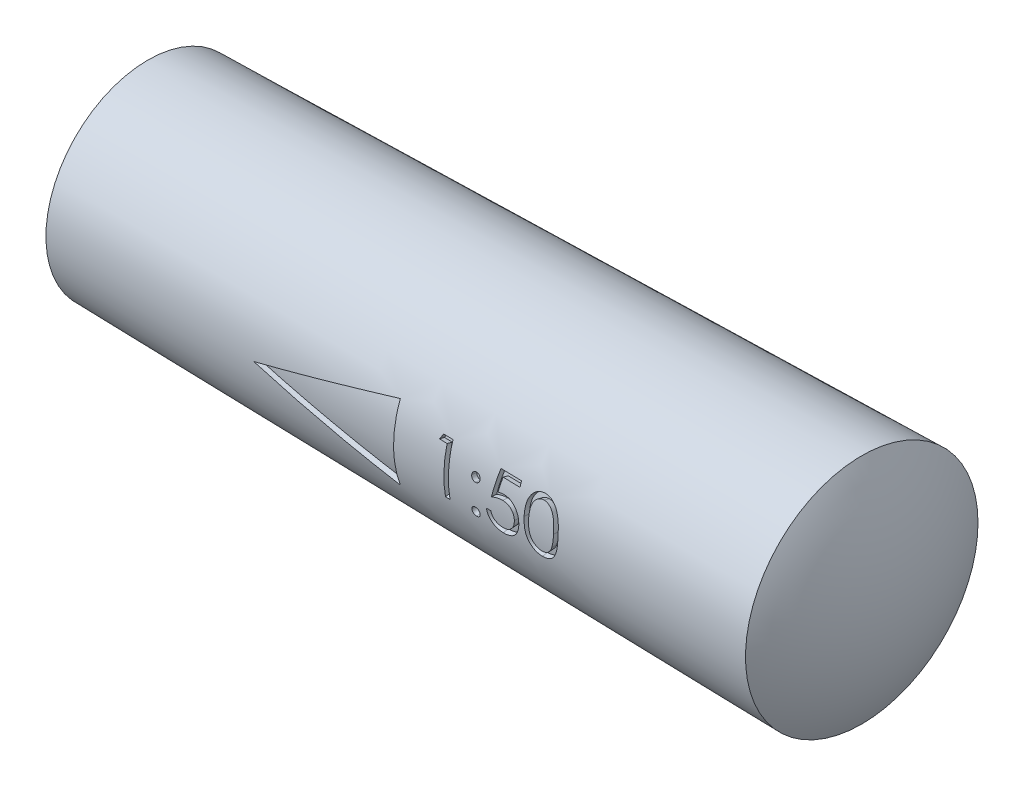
SolidWorks part; units mm, degrees
ref_plane "Front Plane" through (0, 0, 0) normal (0, 0, 1) x (1, 0, 0)
ref_plane "Top Plane" through (0, 0, 0) normal (0, 1, 0) x (1, 0, 0)
ref_plane "Right Plane" through (0, 0, 0) normal (1, 0, 0) x (0, 0, -1)
sketch "Sketch1" plane through (0, 0, 0) normal (1, 0, 0) x (0, 0, -1)
  circle A0 centre (0, 0) radius 2
  dimension "D1" = 4
extrude "Extrude1" add sketch "Sketch1" along normal mid plane 14
draft "Draft1" type of draft neutral plane draft angle 1.146 faces to draft 1 parameters "D1"=1.146
sketch "Sketch2" plane through (0, 0, 0) normal (0, 0, 1) x (1, 0, 0)
  line L0 (-7, 0) -> (-7, 2)
  line L1 (-7, 2) -> (-7, -2) construction
  line L2 (-7, 0) -> (-7.6, 0)
  line L3 (-7.6, 0) -> (-7.6, -2.14) construction
  line L4 (7, 0) -> (7, 2.28)
  line L5 (7, -2.28) -> (7, 2.28) construction
  line L6 (7, 0) -> (7.6, 0)
  line L7 (7.6, 0) -> (7.6, -2.14) construction
  line L8 (-7, -2) -> (7, -2.28) construction
  arc A0 (-7.6, 0) -> (-7, 2) centre (-3.9667, 0) cw
  arc A1 (7.6, 0) -> (7, 2.28) centre (2.968, 0) ccw
  point P14 (0, -2.14)
revolve "Revolve1" add sketch "Sketch2" angle 360 about L2
sketch "Sketch5" plane through (0, 0, 0) normal (0, 0, 1) x (1, 0, 0)
  line L0 (0, 2.14) -> (0, -2.14) construction
  line L1 (7, 2.28) -> (-7, 2) construction
  line L2 (-7, -2) -> (7, -2.28) construction
ref_plane "Plane2" through (0, 0, 0) normal (-0.02, 0, 0.9998) x (0.9998, 0, 0.02)
sketch "Sketch6" plane through (0, 0, 0) normal (-0.02, 0, 0.9998) x (0.9998, 0, 0.02)
  line L0 (0, 0) -> (0, 0.75)
  line L1 (0, 2.14) -> (0, -2.14) construction
  line L2 (0, 0.75) -> (-2.799, 0)
  line L3 (-2.799, 0) -> (0, -0.75)
  line L4 (0, -0.75) -> (0, 0)
  line L5 (0, -0.375) -> (4, -0.375) construction
  text T0 "1:50" font "Century Gothic" height 1
  dimension "D1" = 1.5
  dimension "D2" = 30
  dimension "D3" = 4
wrap "Wrap2" sketch "Sketch6" wrap type deboss source sketch "Sketch6" thickness 0.1 parameters "D1"=0.1
equation "\"D2@Sketch2\" = \"D1@Sketch2\""
